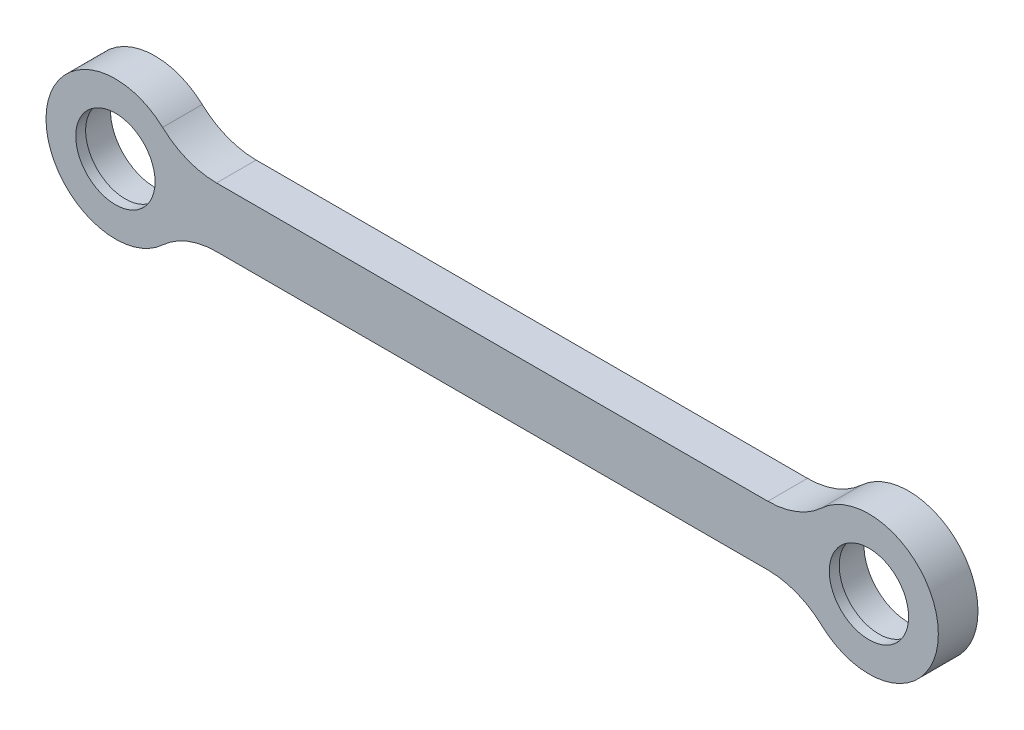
SolidWorks part; units mm, degrees
ref_plane "前视基准面" through (0, 0, 0) normal (0, 0, 1) x (1, 0, 0)
ref_plane "上视基准面" through (0, 0, 0) normal (0, 1, 0) x (1, 0, 0)
ref_plane "右视基准面" through (0, 0, 0) normal (1, 0, 0) x (0, 0, -1)
sketch "草图1" plane through (0, 0, 0) normal (0, 0, 1) x (1, 0, 0)
  line L0 (0, 0) -> (76, 0) construction
  line L1 (6.3246, 3) -> (69.6754, 3)
  line L2 (6.3246, -3) -> (69.6754, -3)
  circle A0 centre (0, 0) radius 2.1
  arc A1 (6.3246, 3) -> (6.3246, -3) centre (0, 0) ccw
  circle A2 centre (76, 0) radius 2.1
  arc A3 (69.6754, -3) -> (69.6754, 3) centre (76, 0) ccw
  dimension "D1" = 4.2
  dimension "D2" = 14
  dimension "D3" = 76
  dimension "D4" = 3
extrude "凸台-拉伸1" add sketch "草图1" along normal blind 4
fillet "圆角1" radius 8 4 edges at (69.6754, 3, 2) (69.6754, -3, 2) (6.3246, -3, 2) (6.3246, 3, 2)
sketch "草图2" plane through (0, 0, 4) normal (0, 0, 1) x (1, 0, 0)
  circle A0 centre (0, 0) radius 4.5
  circle A1 centre (76, 0) radius 4.5
  dimension "D1" = 9
extrude "切除-拉伸1" cut sketch "草图2" against normal blind 4
sketch "草图3" plane through (0, 0, 4) normal (0, 0, 1) x (1, 0, 0)
  circle A0 centre (0, 0) radius 4
  circle A1 centre (76, 0) radius 4.5 construction
  circle A2 centre (0, 0) radius 4.5 construction
  circle A3 centre (76, 0) radius 4.5
  circle A4 centre (0, 0) radius 4.5
  circle A5 centre (76, 0) radius 4
  dimension "D1" = 8
  dimension "D2" = 8
extrude "凸台-拉伸2" add sketch "草图3" against normal blind 1
